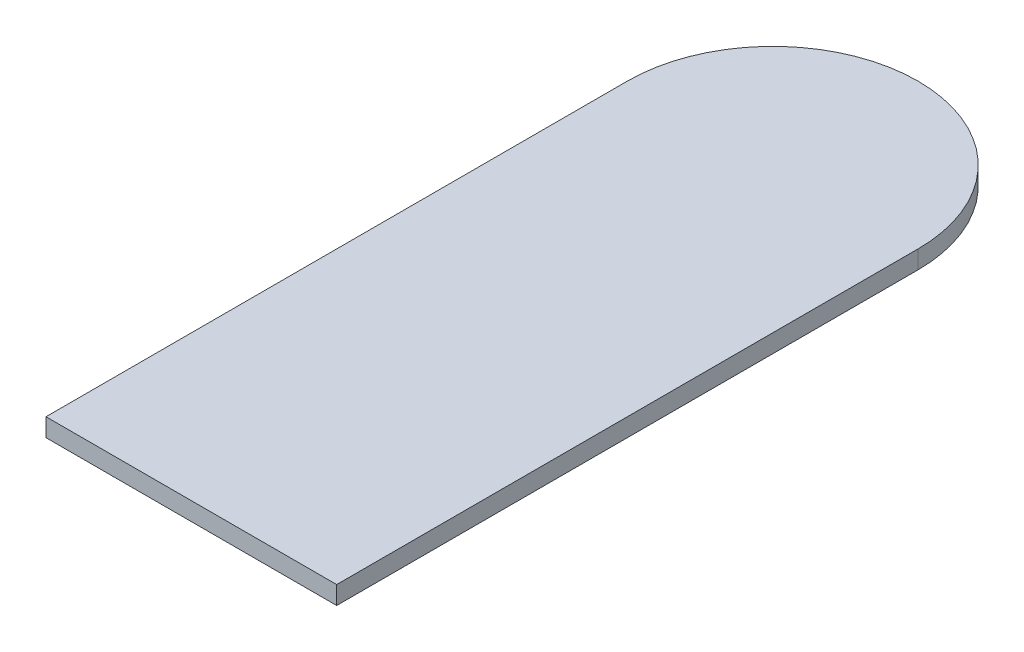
SolidWorks part; units mm, degrees
ref_plane "Front Plane" through (0, 0, 0) normal (0, 0, 1) x (1, 0, 0)
ref_plane "Top Plane" through (0, 0, 0) normal (0, 1, 0) x (1, 0, 0)
ref_plane "Right Plane" through (0, 0, 0) normal (1, 0, 0) x (0, 0, -1)
sketch "Sketch1" plane through (0, 0, 0) normal (0, 1, 0) x (1, 0, 0)
  line L1 (-25.4, -50.8) -> (25.4, -50.8)
  line L2 (-25.4, -50.8) -> (-25.4, 50.8)
  line L4 (25.4, -50.8) -> (25.4, 50.8)
  line L5 (-25.4, -50.8) -> (25.4, 50.8) construction
  line L6 (-25.4, 50.8) -> (25.4, -50.8) construction
  arc A0 (-25.4, 50.8) -> (25.4, 50.8) centre (0, 50.8) cw
  point P0 (0, 0)
  dimension "D1" = 50.8
  dimension "D2" = 101.6
extrude "Boss-Extrude1" add sketch "Sketch1" along normal blind 3.175
